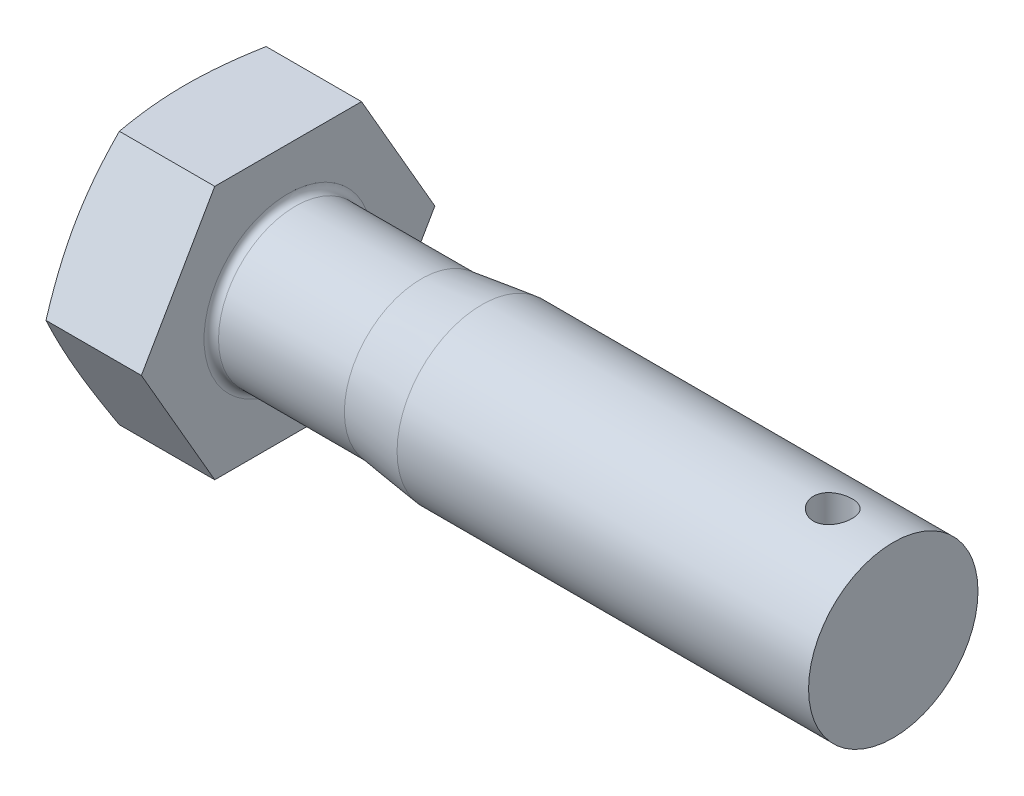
SolidWorks part; units mm, degrees
ref_plane "Front" through (0, 0, 0) normal (0, 0, 1) x (1, 0, 0)
ref_plane "Top" through (0, 0, 0) normal (0, 1, 0) x (1, 0, 0)
ref_plane "Right" through (0, 0, 0) normal (1, 0, 0) x (0, 0, -1)
sketch "Sketch1" plane through (0, 0, 0) normal (1, 0, 0) x (0, 0, -1)
  line L1 (6.0622, -10.5) -> (12.1244, 0)
  line L2 (12.1244, 0) -> (6.0622, 10.5)
  line L3 (6.0622, 10.5) -> (-6.0622, 10.5)
  line L4 (-6.0622, 10.5) -> (-12.1244, 0)
  line L5 (-12.1244, 0) -> (-6.0622, -10.5)
  line L6 (-6.0622, -10.5) -> (6.0622, -10.5)
  circle A0 centre (0, 0) radius 10.5 construction
  dimension "s" = 21
extrude "BaseHead" add sketch "Sketch1" along normal blind 8.8
ref_plane "Plane1" through (24.8, 0, 0) normal (1, 0, 0) x (0, 0, -1)
sketch "Sketch2" plane through (8.8, 0, 0) normal (1, 0, 0) x (0, 0, -1)
  circle A0 centre (0, 0) radius 7
  dimension "d" = 14
extrude "BaseBody" add sketch "Sketch2" along normal blind 50
sketch "Sketch3" plane through (3.1612, 0, 2.6123) normal (0, 1, 0) x (0, 0, -1)
  line L0 (2.6123, 2.0714) -> (2.6123, -1.5224) construction
  line L2 (14.7366, 3.1612) -> (14.7366, 2.2424)
  line L3 (14.7366, 2.2424) -> (12.2123, 3.1612)
  line L5 (12.2123, 3.1612) -> (14.7366, 3.1612)
  dimension "D1" = 20
  dimension "dw" = 19.2
revolve "HeadChamfer" cut sketch "Sketch3" angle 360 about L0
sketch "Sketch4" plane through (0, 0, 0) normal (1, 0, 0) x (0, 0, -1)
  circle A0 centre (0, 0) radius 7.85
  dimension "da" = 15.7
extrude "Cut-Extrude1" cut sketch "Sketch4" along normal blind 1.76
sketch "Sketch5" plane through (-2.9296, 0, 7.9296) normal (0, 1, 0) x (0, 0, -1)
  line L0 (7.9296, -2.9296) -> (7.9296, -19.1832) construction
  line L1 (20.054, -11.7296) -> (13.9918, -11.7296) construction
  line L2 (14.9296, -27.7296) -> (14.2801, -22.7296)
  line L3 (10.9296, -2.9296) -> (10.9296, -19.1832) construction
  line L4 (14.2801, -22.7296) -> (14.2801, -11.7296)
  line L5 (14.9296, -61.7296) -> (14.9296, -11.7296) construction
  line L6 (14.2801, -11.7296) -> (20.6306, -11.7296)
  line L7 (20.6306, -11.7296) -> (20.6306, -27.7296)
  line L8 (20.6306, -27.7296) -> (14.9296, -27.7296)
  line L9 (0.9296, -61.7296) -> (14.9296, -61.7296) construction
  dimension "D1" = 3
  dimension "ds" = 12.701
  dimension "x" = 5
  dimension "D3" = 34
  dimension "D4" = 25.402
revolve "Cut-Revolve1" cut sketch "Sketch5" angle 360 about L0
fillet "HeadFillet" radius 0.6 1 edges at (8.8, 0, 6.3505)
sketch "Sketch6" plane through (0, 0, 0) normal (0, 1, 0) x (1, 0, 0)
  line L0 (8.8, -6.0622) -> (8.8, -12.1244) construction
  circle A0 centre (53.8, 0) radius 1.6
  dimension "d1" = 3.2
  dimension "lh" = 45
extrude "Hole" cut sketch "Sketch6" against normal through all and the other way through all
equation "\"D1@Cut-Extrude1\" = 0.2 * \"k@BaseHead\""
equation "\"b@ThreadCosmetic1\" = \"l@BaseBody\" - \"lg@Plane1\""
equation "\"D4@Sketch5\" = 2 * \"ds@Sketch5\""
equation "\"D3@Sketch5\" = \"l@BaseBody\" - \"lg@Plane1\""
